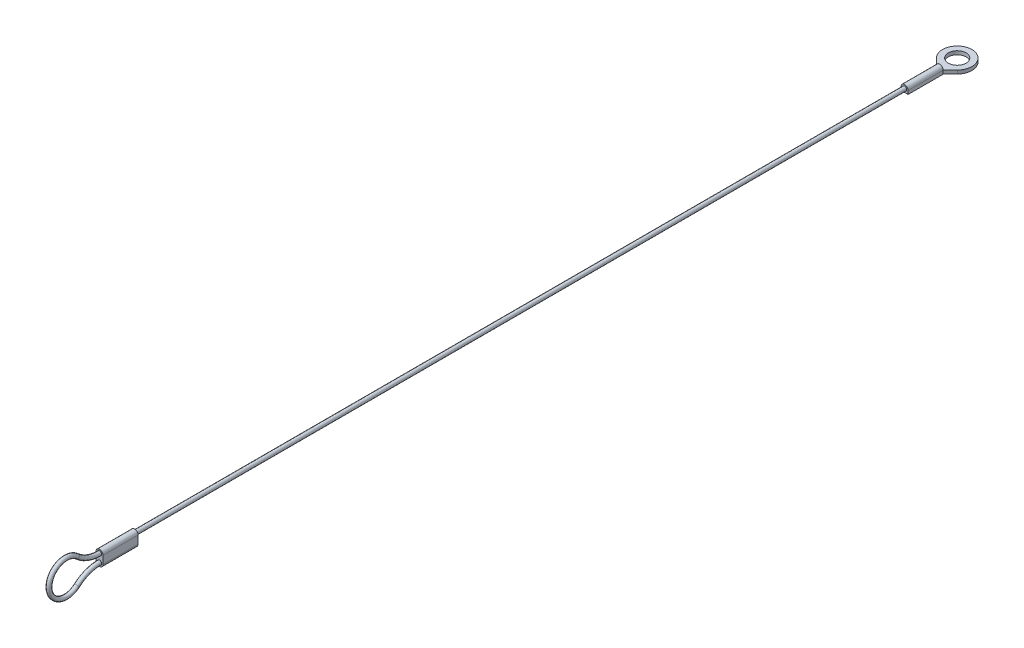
SolidWorks part; units mm, degrees
ref_plane "Front Plane" through (0, 0, 0) normal (0, 0, 1) x (1, 0, 0)
ref_plane "Top Plane" through (0, 0, 0) normal (0, 1, 0) x (1, 0, 0)
ref_plane "Right Plane" through (0, 0, 0) normal (1, 0, 0) x (0, 0, -1)
sketch "Sketch1" plane through (0, 0, 0) normal (1, 0, 0) x (0, 0, -1)
  line L2 (-229.4, 0) -> (0, 0)
  arc A0 (-229.4, 0) -> (-235.8, 2.4446) centre (-229.4, 9.6) cw
  arc A1 (-235.8, 2.4446) -> (-235.8, -4.7108) centre (-239, -1.1331) ccw
  arc A2 (-235.8, -4.7108) -> (-229.4, -2.2663) centre (-229.4, -11.8663) cw
  dimension "D1" = 4.8
  dimension "D4" = 9.6
  dimension "D2" = 239
  dimension "D3" = 9.6
sketch "Sketch2" plane through (0, 0, 0) normal (0, 0, 1) x (1, 0, 0)
  circle A0 centre (0, 0) radius 0.595
  dimension "D1" = 1.19
sweep "Sweep1" add profiles "Sketch2" path "Sketch1"
sketch "Sketch3" plane through (0, 0, 229.4) normal (0, 0, -1) x (-1, 0, 0)
  line L0 (0, 0) -> (0, -2.2663) construction
  line L1 (0.995, 0) -> (0.995, -2.2663)
  line L2 (-0.995, 0) -> (-0.995, -2.2663)
  line L3 (-0.595, -2.2663) -> (0.595, -2.2663) construction
  arc A0 (0.995, 0) -> (-0.995, 0) centre (0, 0) ccw
  arc A1 (-0.995, -2.2663) -> (0.995, -2.2663) centre (0, -2.2663) ccw
  point P3 (0, -1.1331)
  dimension "D1" = 1.99
extrude "Boss-Extrude1" add sketch "Sketch3" along normal blind 10
sketch "Sketch4" plane through (0, 0, 0) normal (0, 0, -1) x (-1, 0, 0)
  line L0 (-0.995, 0) -> (-0.995, -0.995)
  line L1 (-0.995, -0.995) -> (0, -0.995)
  line L2 (0, -0.995) -> (0.995, -0.995)
  line L3 (0.995, -0.995) -> (0.995, 0)
  arc A0 (0.995, 0) -> (-0.995, 0) centre (0, 0) ccw
  dimension "D1" = 1.99
extrude "Boss-Extrude2" add sketch "Sketch4" along normal blind 10
sketch "Sketch5" plane through (0, -0.995, 0) normal (0, -1, 0) x (1, 0, 0)
  line L0 (-0.995, -10) -> (0.995, -10)
  line L1 (0.995, -10) -> (3.0131, -12.0884)
  line L2 (-3.0131, -12.0884) -> (-0.995, -10)
  arc A0 (3.0131, -12.0884) -> (-3.0131, -12.0884) centre (0, -15) cw
  circle A1 centre (0, -15) radius 2.54
  point P8 (-4.19, -15)
  point P9 (4.19, -15)
  dimension "D1" = 5.08
  dimension "D2" = 8.38
  dimension "D3" = 15
extrude "Boss-Extrude3" add sketch "Sketch5" against normal blind 1.01
